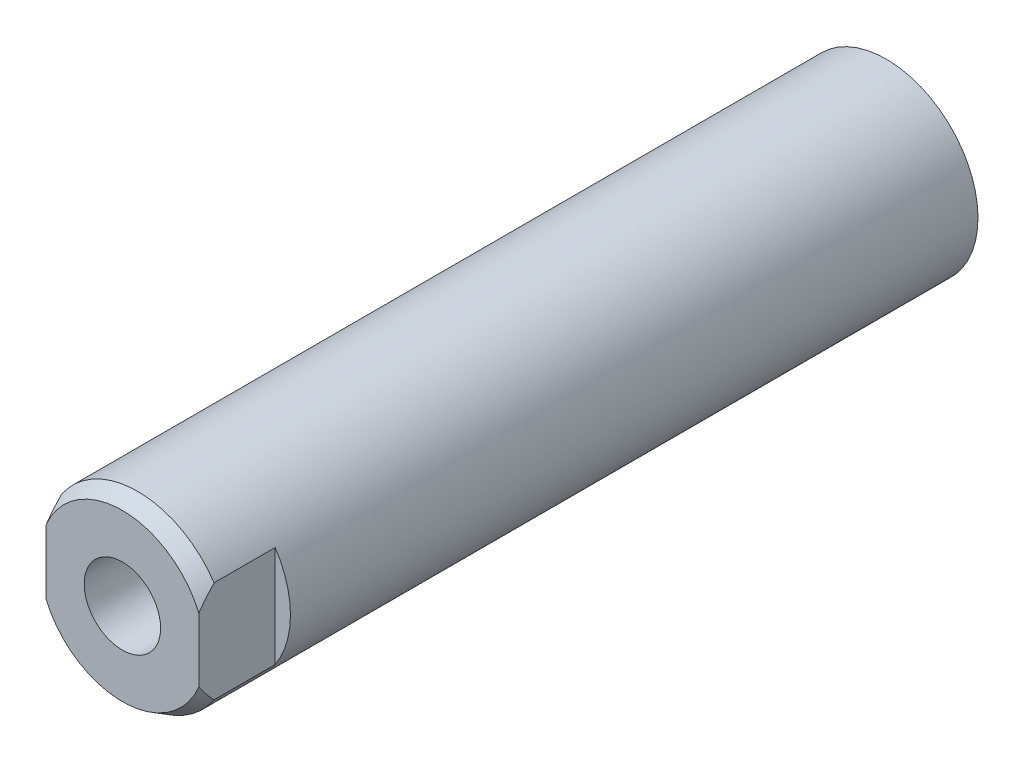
SolidWorks part; units mm, degrees
ref_plane "Front Plane" through (0, 0, 0) normal (0, 0, 1) x (1, 0, 0)
ref_plane "Top Plane" through (0, 0, 0) normal (0, 1, 0) x (1, 0, 0)
ref_plane "Right Plane" through (0, 0, 0) normal (1, 0, 0) x (0, 0, -1)
sketch "Sketch1" plane through (0, 0, 0) normal (0, 0, 1) x (1, 0, 0)
  circle A0 centre (0, 0) radius 6
  dimension "D1" = 12
extrude "Extrude1" add sketch "Sketch1" against normal blind 50
sketch "Sketch2" plane through (0, 0, 0) normal (0, 0, 1) x (1, 0, 0)
  circle A0 centre (0, 0) radius 6
  dimension "D1" = 12
extrude "Extrude2" add sketch "Sketch2" along normal blind 8
chamfer "Chamfer2" distance 0.5 angle 45 1 edges at (6, 0, 8)
sketch "Sketch6" plane through (0, 0, 0) normal (0, 0, 1) x (1, 0, 0)
  circle A0 centre (0, 0) radius 5
  circle A1 centre (0, 0) radius 6.5
  dimension "D1" = 13
  dimension "D2" = 10
extrude "Cut-Extrude1" cut sketch "Sketch6" along normal blind 1
chamfer "Chamfer3" distance 1 angle 30 1 edges at (6, 0, 0)
sketch "Sketch7" plane through (0, 0, 0) normal (0, 1, 0) x (1, 0, 0)
  line L0 (-5, 0) -> (5, 0) construction
  line L1 (5, 0) -> (7.5864, 0)
  line L2 (5, 0) -> (5, 5)
  line L3 (5, 5) -> (7.5864, 5)
  line L4 (7.5864, 0) -> (7.5864, 5)
  line L5 (-7.6041, 0) -> (-5, 0)
  line L6 (-7.6041, 0) -> (-7.6041, 5)
  line L7 (-7.6041, 5) -> (-5, 5)
  line L8 (-5, 0) -> (-5, 5)
  line L9 (-5, 0) -> (5, 0) construction
  dimension "D1" = 5
  dimension "D2" = 10
extrude "Cut-Extrude2" cut sketch "Sketch7" against normal mid plane 21
sketch "Sketch8" plane through (0, 0, 8) normal (0, 0, 1) x (1, 0, 0)
  circle A0 centre (0, 0) radius 6
extrude "Cut-Extrude3" cut sketch "Sketch8" against normal up to vertex (8 mm away)
hole_wizard "M6 Tapped Hole1" positions "Sketch12" profile "Sketch11" tap size "M6" standard "ISO"
sketch "Sketch12" plane through (0, 0, 0) normal (0, 0, 1) x (1, 0, 0)
  point P0 (0, 0)
sketch "Sketch11" plane through (0, 0, 0) normal (1, 0, 0) x (0, -1, 0)
  line L0 (0, 0) -> (0, 22.5022)
  line L1 (0, 22.5022) -> (2.5, 21)
  line L2 (2.5, 21) -> (2.5, 0)
  line L5 (2.5, 0) -> (0, 0)
  line L10 (0, 22.5022) -> (-2.5, 21) construction
  line L11 (0, -6.35) -> (0, 107.95) construction
  dimension "Tap Drill Dia." = 5
  dimension "Tap Drill Depth" = 21
  dimension "Drill Angle" = 118
